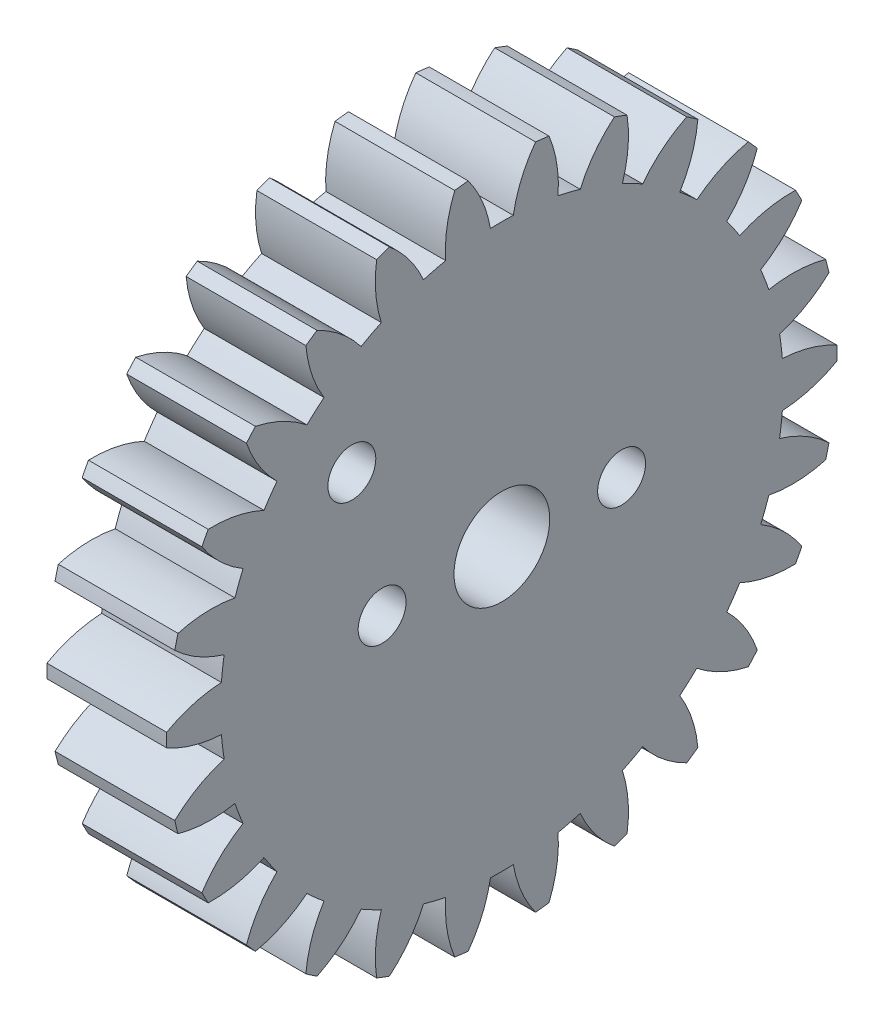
SolidWorks part; units mm, degrees
ref_plane "Front Plane" through (0, 0, 0) normal (0, 0, 1) x (1, 0, 0)
ref_plane "Top Plane" through (0, 0, 0) normal (0, 1, 0) x (1, 0, 0)
ref_plane "Right Plane" through (0, 0, 0) normal (1, 0, 0) x (0, 0, -1)
inserted part "spur gear_am<6>@tmpAssm"
sketch "Sketch1" plane through (-5.7393, 0, 0) normal (1, 0, 0) x (0, 0, -1)
  line L0 (-42.4846, -49.2195) -> (-32.152, -49.2195) construction
  line L1 (-42.4846, -49.2195) -> (-48.8638, -43.3024) construction
  line L2 (-42.4846, -49.2195) -> (-42.4846, -41.461) construction
  circle A0 centre (-37.4846, -49.2195) radius 1
  circle A1 centre (-48.7487, -43.4091) radius 1
  circle A2 centre (-47.4846, -49.2195) radius 1
  circle A3 centre (-42.4846, -49.2195) radius 2 construction
  dimension "D2" = 5
  dimension "D3" = 5
  dimension "D4" = 8.544
  dimension "D1" = 137.152
extrude "Cut-Extrude1" cut sketch "Sketch1" against normal blind 10
sketch "Sketch2" plane through (-5.7393, 0, 0) normal (1, 0, 0) x (0, 0, -1)
  line L0 (-42.4846, -49.2195) -> (-32.0174, -49.2195)
